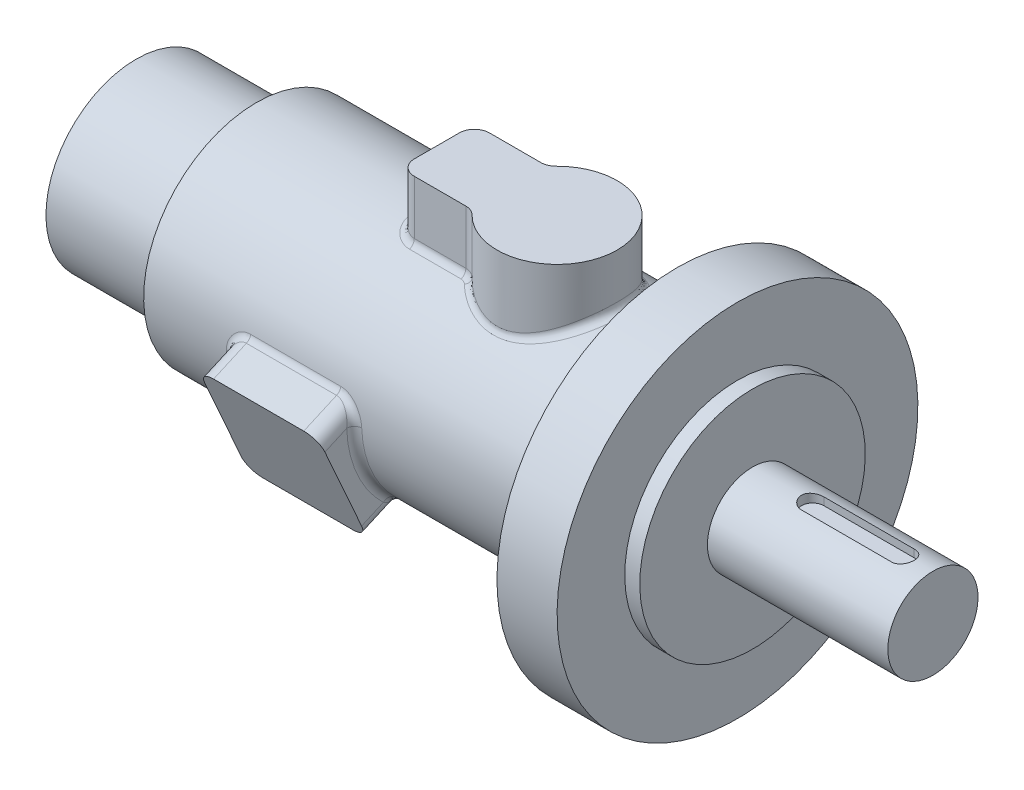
SolidWorks part; units mm, degrees
ref_plane "Front" through (0, 0, 0) normal (0, 0, 1) x (1, 0, 0)
ref_plane "Top" through (0, 0, 0) normal (0, 1, 0) x (1, 0, 0)
ref_plane "Right" through (0, 0, 0) normal (1, 0, 0) x (0, 0, -1)
sketch "Sketch1" plane through (0, 0, 0) normal (0, 0, 1) x (1, 0, 0)
  line L0 (42.975, 0) -> (28.575, 0) construction
  line L1 (0, 0) -> (0, 23.8125)
  line L2 (0, 23.8125) -> (-3.175, 23.8125)
  line L3 (-3.175, 23.8125) -> (-3.175, 38.1)
  line L4 (-3.175, 38.1) -> (-15.875, 38.1)
  line L5 (-15.875, 38.1) -> (-15.875, 23.8125)
  line L6 (-15.875, 23.8125) -> (-104.775, 23.8125)
  line L7 (-104.775, 23.8125) -> (-104.775, 19.05)
  line L8 (-104.775, 19.05) -> (-130.175, 19.05)
  line L9 (-130.175, 19.05) -> (-130.175, 0)
  line L10 (-130.175, 0) -> (0, 0)
  line L14 (0, 0) -> (-120.4051, 0) construction
  dimension "D1" = 47.625
  dimension "D2" = 3.175
  dimension "D3" = 12.7
  dimension "D4" = 76.2
  dimension "D5" = 127
  dimension "D6" = 25.4
  dimension "D7" = 38.1
revolve "case" add sketch "Sketch1" angle 360 about L0
sketch "Sketch2" plane through (0, 0, 0) normal (0, 1, 0) x (1, 0, 0)
  line L0 (0, 0) -> (-124.2367, 0) construction
  line L1 (-3.175, -38.1) -> (-3.175, 38.1) construction
  line L2 (-66.675, 7.9375) -> (-51.1889, 7.9375)
  line L3 (-66.675, -7.9375) -> (-51.1889, -7.9375)
  line L4 (-66.675, 7.9375) -> (-66.675, -7.9375)
  arc A1 (-51.1889, -7.9375) -> (-51.1889, 7.9375) centre (-41.275, 0) ccw
  dimension "D2" = 12.7
  dimension "D3" = 25.4
  dimension "D1" = 38.1
  dimension "D4" = 7.9375
extrude "upper" add sketch "Sketch2" along normal blind 34.925
ref_plane "angle front" through (0, 0, 0) normal (0, -0.4067, 0.9135) x (1, 0, 0)
sketch "Sketch3" plane through (0, 0, 0) normal (0, -0.4067, 0.9135) x (1, 0, 0)
  line L1 (-85.725, -12.7) -> (-60.325, -12.7)
  line L2 (-85.725, -12.7) -> (-85.725, 12.7)
  line L3 (-85.725, 12.7) -> (-60.325, 12.7)
  line L4 (-60.325, -12.7) -> (-60.325, 12.7)
  line L6 (-15.875, 38.1) -> (-15.875, -38.1) construction
  line L7 (-85.725, 0) -> (-60.325, 0) construction
  line L8 (42.975, 0) -> (28.575, 0) construction
  dimension "D1" = 44.45
  dimension "D2" = 25.4
  dimension "D3" = 25.4
extrude "side" add sketch "Sketch3" along normal blind 28.575
fillet "Fillet1" radius 3.175 8 edges at (-66.675, 28.6878, -7.9375) (-51.1889, 28.6878, -7.9375) (-51.1889, 28.6878, 7.9375) (-66.675, 28.6878, 7.9375) (-60.325, 1.6943, 27.4187) (-85.725, 1.6943, 27.4187) (-85.725, -21.5097, 17.0876) (-60.325, -21.5097, 17.0876)
fillet "Fillet2" radius 1.5875 16 edges at (-84.3216, -19.4359, 13.7579) (-73.025, -19.795, 13.2361) (-61.1589, -19.1035, 14.2159) (-60.325, -9.6854, 21.7538) (-85.725, -9.6854, 21.7538) (-61.7284, 2.7811, 23.6495) (-84.8911, 2.2182, 23.709) (-66.675, 23.8125, 0) (-65.9498, 22.8262, -6.7821) (-58.056, 22.4506, -7.9375) (-51.6109, 22.3927, -8.0995) (-28.7569, 23.716, -2.1418) (-65.4072, 22.6657, 7.3009) (-58.056, 22.4506, 7.9375) (-51.1647, 22.3241, 8.2866) (-73.025, 3.4091, 23.5672)
sketch "Sketch4" plane through (0, 0, 0) normal (1, 0, 0) x (0, 0, -1)
  circle A0 centre (0, 0) radius 9.525
  dimension "D1" = 19.05
extrude "shaft" add sketch "Sketch4" along normal blind 38.1
sketch "Sketch21" plane through (-45.5434, 34.925, -1.2107) normal (0, -1, 0) x (1, 0, 0)
  line L0 (4.2684, 4.3857) -> (4.2684, -1.9643) construction
  line L1 (3.175, 0) -> (-3.175, 0) construction
  circle A0 centre (4.2684, 1.2107) radius 12.7 construction
  point P5 (4.2684, 1.2107)
  dimension "D3" = 6.35
ref_plane "Plane1" through (-41.275, 34.925, 0) normal (0, 0, -1) x (-1, 0, 0)
sketch "Port Sketch" plane through (-41.9394, 34.925, 0) normal (0, 0, 1) x (-1, 0, 0)
  line L0 (-0.6644, 0) -> (-0.6644, 45.0293) construction
  line L1 (-0.6644, 15.6756) -> (2.79, 13.6)
  line L2 (2.79, 13.6) -> (2.79, 11.6)
  line L3 (2.79, 11.6) -> (3.3044, 11.6)
  line L4 (3.3044, 11.6) -> (3.3044, 3.6542)
  line L5 (3.3044, 3.6542) -> (3.2586, 3.7)
  line L6 (3.2586, 3.7) -> (3.6622, 1.8012)
  line L7 (3.9106, 1.6) -> (7.8356, 1.6)
  line L8 (7.8356, 1.6) -> (7.8356, 0)
  line L10 (7.8356, 0) -> (-0.6644, 0)
  line L11 (-0.6644, 0) -> (-0.6644, 15.6756)
  line L12 (-4.5873, 3.7) -> (-4.9909, 1.8012) construction
  line L13 (-4.6331, 3.6542) -> (-4.5873, 3.7) construction
  line L14 (-0.6644, 15.6756) -> (-4.1188, 13.6) construction
  arc A0 (3.6622, 1.8012) -> (3.9106, 1.6) centre (3.9106, 1.854) ccw
  dimension "D1" = 0.254
  dimension "Countersink angle" = 118
  dimension "D3" = 45
  dimension "TapDrillDia" = 6.9088
  dimension "D5" = 9.15
  dimension "ThdMjr" = 7.9375
  dimension "SpotDia" = 17
  dimension "L3" = 1.6
  dimension "L1" = 2.1
  dimension "ThdDp" = 10
  dimension "TapDrillDp" = 12
  dimension "K" = 12
revolve "SAE Port" cut sketch "Port Sketch" angle 360 about L0
other "sae j1926-1 (circular face)<1>"
sketch "Sketch23" plane through (-28.5302, 39.501, 48.8662) normal (0, 0.4067, -0.9135) x (-1, 0, 0)
  line L0 (41.3198, -55.9616) -> (47.6698, -55.9616) construction
  line L1 (44.4948, -52.7866) -> (44.4948, -59.1366) construction
  line L2 (31.7948, -46.4366) -> (31.7948, -65.4866) construction
  line L3 (54.0198, -43.2616) -> (34.9698, -43.2616) construction
  point P4 (44.4948, -55.9616)
  dimension "Locating dim1" = 12.7
  dimension "Locating dim2" = 12.7
  dimension "D3" = 6.35
ref_plane "Plane12" through (-73.025, -11.6225, 26.1046) normal (-1, 0, 0) x (0, 0, 1)
sketch "Port Sketch2" plane through (-73.025, -57.5953, 5.6362) normal (1, 0, 0) x (0, -0.9135, -0.4067)
  line L0 (-50.3235, 0) -> (-50.3235, 45.0293) construction
  line L1 (-50.3235, 18.5806) -> (-45.3629, 15.6)
  line L2 (-45.3629, 15.6) -> (-45.3629, 13.1)
  line L3 (-45.3629, 13.1) -> (-44.7672, 13.1)
  line L4 (-44.7672, 13.1) -> (-44.7672, 4.1104)
  line L5 (-44.7672, 4.1104) -> (-44.8568, 4.2)
  line L6 (-44.8568, 4.2) -> (-44.3469, 1.8012)
  line L7 (-44.0985, 1.6) -> (-39.8235, 1.6)
  line L8 (-39.8235, 1.6) -> (-39.8235, 0)
  line L10 (-39.8235, 0) -> (-50.3235, 0)
  line L11 (-50.3235, 0) -> (-50.3235, 18.5806)
  line L12 (-55.7901, 4.2) -> (-56.3, 1.8012) construction
  line L13 (-55.8797, 4.1104) -> (-55.7901, 4.2) construction
  line L14 (-50.3235, 18.5806) -> (-55.2841, 15.6) construction
  arc A0 (-44.3469, 1.8012) -> (-44.0985, 1.6) centre (-44.0985, 1.854) ccw
  dimension "D1" = 0.254
  dimension "Countersink angle" = 118
  dimension "D3" = 45
  dimension "TapDrillDia" = 9.9212
  dimension "D5" = 12.45
  dimension "ThdMjr" = 11.1125
  dimension "SpotDia" = 21
  dimension "L3" = 1.6
  dimension "L1" = 2.6
  dimension "ThdDp" = 11.5
  dimension "TapDrillDp" = 14
  dimension "K" = 12
revolve "SAE Port2" cut sketch "Port Sketch2" angle 360 about L0
other "sae j1926-1 (rectangular face)<1>"
sketch "Sketch27" plane through (38.1, -2.0338, -3.6084) normal (1, 0, 0) x (0, 0, -1)
  line L0 (-3.6084, 11.5588) -> (-3.6084, 2.0338) construction
  line L1 (-3.6084, 2.0338) -> (-3.6084, 11.5588) construction
  circle A0 centre (-3.6084, 2.0338) radius 9.525 construction
  circle A2 centre (-3.6084, 2.0338) radius 9.525
  dimension "Angle from vertical" = 0
ref_plane "Plane16" through (38.1, 9.525, 0) normal (0, -1, 0) x (-1, 0, 0)
sketch "Sketch33" plane through (38.1, 9.525, 1.8042) normal (0, -1, 0) x (1, 0, 0)
  line L0 (-6.35, -1.8042) -> (-25.4, -1.8042) construction
  line L1 (-6.35, 0.5771) -> (-25.4, 0.5771)
  line L2 (-6.35, -4.1854) -> (-25.4, -4.1854)
  arc A0 (-6.35, 0.5771) -> (-6.35, -4.1854) centre (-6.35, -1.8042) cw
  arc A1 (-25.4, 0.5771) -> (-25.4, -4.1854) centre (-25.4, -1.8042) ccw
  dimension "Keyway width" = 4.7625
  dimension "Distance from end face" = 6.35
  dimension "Length of slot" = 19.05
extrude "Cut-Extrude1" cut sketch "Sketch33" along normal blind 1.9177
other "rectangular keyseat<1>"
